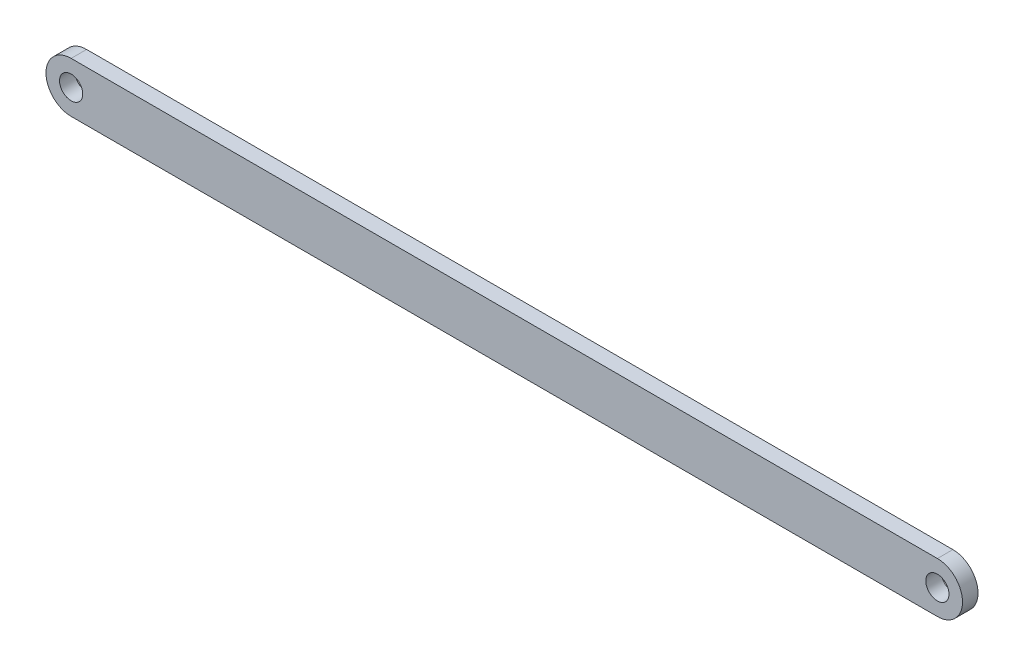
SolidWorks part; units mm, degrees
ref_plane "Front Plane" through (0, 0, 0) normal (0, 0, 1) x (1, 0, 0)
ref_plane "Top Plane" through (0, 0, 0) normal (0, 1, 0) x (1, 0, 0)
ref_plane "Right Plane" through (0, 0, 0) normal (1, 0, 0) x (0, 0, -1)
sketch "Sketch1" plane through (0, 0, 0) normal (0, 0, 1) x (1, 0, 0)
  line L0 (0, 20.6375) -> (711.2, 20.6375)
  line L1 (711.2, -20.6375) -> (0, -20.6375)
  arc A0 (711.2, 20.6375) -> (711.2, -20.6375) centre (711.2, 0) cw
  arc A1 (0, -20.6375) -> (0, 20.6375) centre (0, 0) cw
  circle A2 centre (0, 0) radius 9.525
  circle A3 centre (711.2, 0) radius 9.525
  dimension "D3" = 19.05
  dimension "D1" = 711.2
  dimension "D2" = 41.275
extrude "Extrude1" add sketch "Sketch1" along normal blind 12.7
